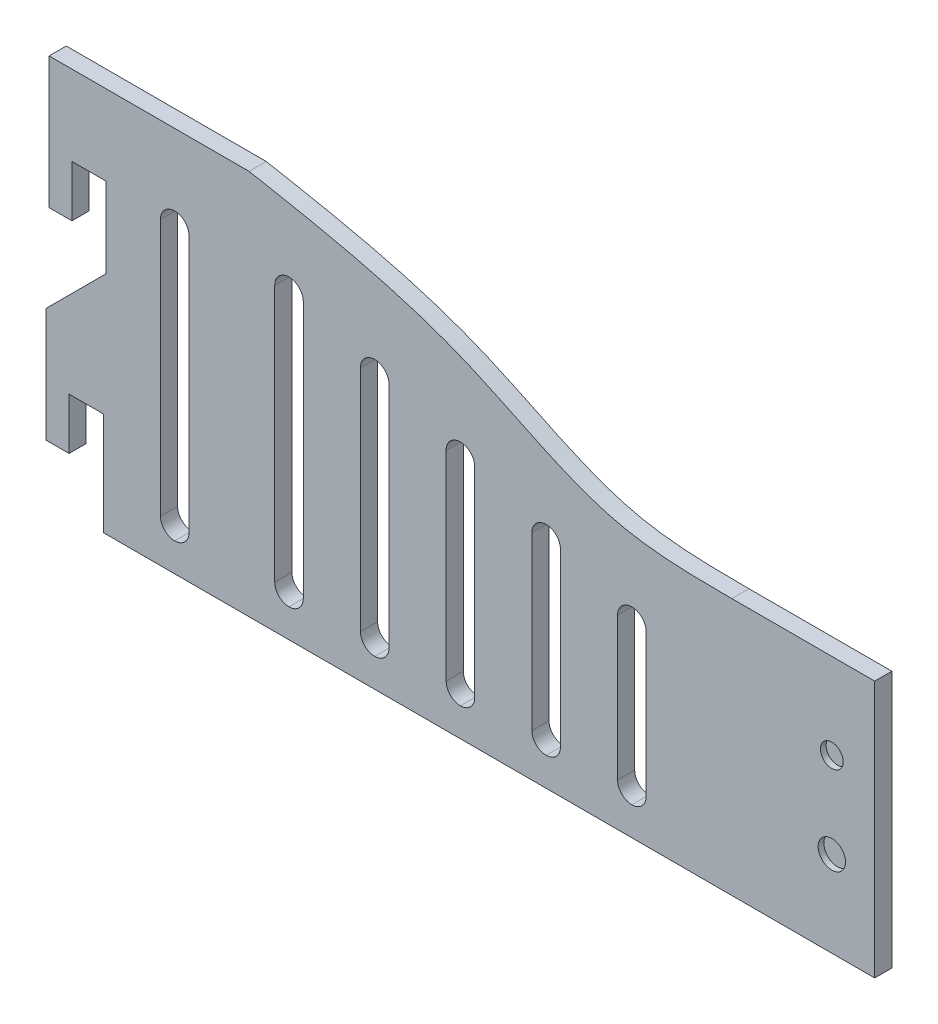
SolidWorks part; units mm, degrees
ref_plane "Plan de face" through (0, 0, 0) normal (0, 0, 1) x (1, 0, 0)
ref_plane "Plan de dessus" through (0, 0, 0) normal (0, 1, 0) x (1, 0, 0)
ref_plane "Plan de droite" through (0, 0, 0) normal (1, 0, 0) x (0, 0, -1)
sketch "Esquisse1" plane through (0, 0, 0) normal (0, 0, 1) x (1, 0, 0)
  line L0 (0, 0) -> (135, 0)
  line L1 (135, 0) -> (135, 45)
  line L2 (135, 45) -> (110, 45)
  line L3 (0, 0) -> (0, 18)
  line L4 (0, 18) -> (-6, 18)
  line L5 (-6, 18) -> (-6, 9)
  line L6 (-6, 9) -> (-10, 9)
  line L7 (-10, 9) -> (-10, 29)
  line L8 (-10, 29) -> (0.5147, 39.5147)
  line L9 (0.5147, 39.5147) -> (0.5147, 53.5147)
  line L10 (0.5147, 53.5147) -> (-5.4853, 53.5147)
  line L11 (-5.4853, 53.5147) -> (-5.4853, 44.5147)
  line L12 (-5.4853, 44.5147) -> (-9.4853, 44.5147)
  line L13 (-9.4853, 44.5147) -> (-9.4853, 67.5147)
  line L14 (-9.4853, 67.5147) -> (25.5147, 67.5147)
  line L15 (30, 55) -> (35, 55)
  line L16 (10, 55) -> (15, 55)
  line L17 (10, 55) -> (10, 5)
  line L18 (10, 5) -> (15, 5)
  line L19 (15, 55) -> (15, 5)
  line L20 (30, 55) -> (30, 5)
  line L21 (30, 5) -> (35, 5)
  line L22 (35, 55) -> (35, 5)
  line L24 (45, 50) -> (50, 50)
  line L25 (45, 50) -> (45, 5)
  line L26 (45, 5) -> (50, 5)
  line L27 (50, 50) -> (50, 5)
  line L28 (60, 45) -> (65, 45)
  line L29 (60, 45) -> (60, 5)
  line L30 (60, 5) -> (65, 5)
  line L31 (65, 45) -> (65, 5)
  line L32 (75, 40) -> (80, 40)
  line L33 (75, 40) -> (75, 5)
  line L34 (75, 5) -> (80, 5)
  line L35 (80, 40) -> (80, 5)
  line L36 (90, 35) -> (95, 35)
  line L37 (90, 35) -> (90, 5)
  line L38 (90, 5) -> (95, 5)
  line L39 (95, 35) -> (95, 5)
  spline S0 degree 3 poles (25.5147, 67.5147) (38.452, 65.0865) (60.8662, 60.8797) (86.7647, 45.0653) (103.2533, 45.019) (110, 45) knots 0 0 0 0 0.446467 0.773512 1 1 1 1
extrude "Extrusion1" add sketch "Esquisse1" along normal blind 3
fillet "Congé1" radius 2.5 1 edges at (15, 55, 1.5)
fillet "Congé2" radius 2.5 1 edges at (10, 55, 1.5)
fillet "Congé3" radius 2.5 1 edges at (30, 55, 1.5)
fillet "Congé4" radius 2.5 1 edges at (45, 50, 1.5)
fillet "Congé5" radius 2.5 1 edges at (60, 45, 1.5)
fillet "Congé6" radius 2.5 1 edges at (75, 40, 1.5)
fillet "Congé7" radius 2.5 1 edges at (35, 55, 1.5)
fillet "Congé8" radius 2.5 4 edges at (95, 35, 1.5) (80, 40, 1.5) (65, 45, 1.5) (50, 50, 1.5)
fillet "Congé9" radius 2.5 1 edges at (90, 35, 1.5)
fillet "Congé10" radius 2.5 6 edges at (90, 5, 1.5) (75, 5, 1.5) (60, 5, 1.5) (45, 5, 1.5) (30, 5, 1.5) (10, 5, 1.5)
fillet "Congé11" radius 2.5 6 edges at (15, 5, 1.5) (35, 5, 1.5) (50, 5, 1.5) (65, 5, 1.5) (80, 5, 1.5) (95, 5, 1.5)
sketch "Esquisse2" plane through (0, 0, 3) normal (0, 0, 1) x (1, 0, 0)
  circle A0 centre (127.5, 15) radius 2.4
  circle A1 centre (127.5, 30) radius 2
extrude "Extrusion2" cut sketch "Esquisse2" against normal blind 1
